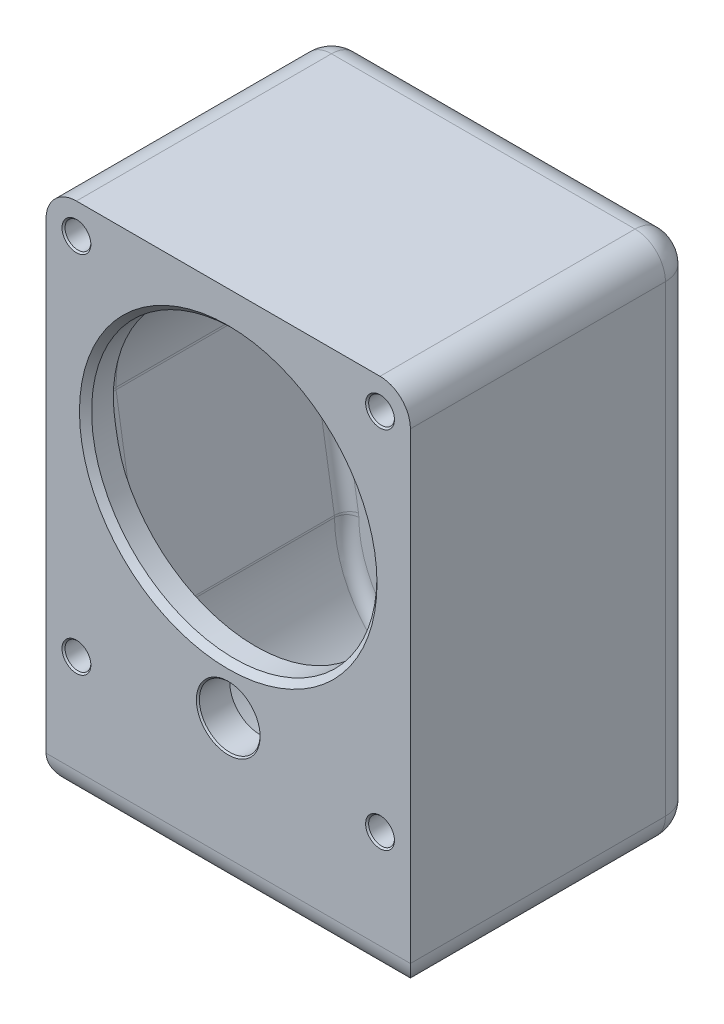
SolidWorks part; units mm, degrees
ref_plane "Face" through (0, 0, 0) normal (0, 0, 1) x (1, 0, 0)
ref_plane "Dessus" through (0, 0, 0) normal (0, 1, 0) x (1, 0, 0)
ref_plane "Droite" through (0, 0, 0) normal (1, 0, 0) x (0, 0, -1)
sketch "Esquisse1" plane through (0, 0, 0) normal (0, 0, 1) x (1, 0, 0)
  line L0 (-50, 62.5) -> (-40, 0)
  line L1 (-60, 122.5) -> (60, 122.5)
  line L2 (-60, 122.5) -> (-60, -50)
  line L3 (-60, -50) -> (60, -50)
  line L4 (60, 122.5) -> (60, -50)
  line L5 (50, 62.5) -> (40, 0)
  arc A0 (40, 0) -> (-40, 0) centre (0, 0) cw
  arc A1 (-50, 62.5) -> (50, 62.5) centre (0, 62.5) cw
  point P0 (0, 62.5)
  dimension "D2" = 40
  dimension "D3" = 50
  dimension "D1" = 62.5
  dimension "D4" = 60
  dimension "D5" = 60
  dimension "D6" = 60
  dimension "D7" = 60
  dimension "D8" = 50
extrude "Base-Extrusion" add sketch "Esquisse1" along normal blind 70
sketch "Esquisse3" plane through (0, 0, 70) normal (0, 0, 1) x (1, 0, 0)
  line L1 (-60, 122.5) -> (60, 122.5)
  line L2 (-60, 122.5) -> (-60, -50)
  line L3 (-60, -50) -> (60, -50)
  line L4 (60, 122.5) -> (60, -50)
extrude "Boss.-Extru.1" add sketch "Esquisse3" along normal blind 9
sketch "Esquisse5" plane through (0, 0, 70) normal (0, 0, -1) x (-1, 0, 0)
  circle A0 centre (0, 0) radius 10
  circle A1 centre (0, 0) radius 12.5
  dimension "D1" = 25
extrude "Boss.-Extru.2" add sketch "Esquisse5" along normal blind 1.5
sketch "Esquisse6" plane through (0, 0, 0) normal (0, 0, -1) x (-1, 0, 0)
  line L1 (-60, 122.5) -> (60, 122.5)
  line L2 (-60, 122.5) -> (-60, -50)
  line L3 (-60, -50) -> (60, -50)
  line L4 (60, 122.5) -> (60, -50)
extrude "Boss.-Extru.3" add sketch "Esquisse6" along normal blind 15
sketch "Esquisse7" plane through (0, 0, -15) normal (0, 0, -1) x (-1, 0, 0)
  circle A0 centre (0, 62.5) radius 40
  dimension "D1" = 80
  dimension "D2" = 62.5
extrude "Boss.-Extru.4" add sketch "Esquisse7" along normal blind 10
sketch "Esquisse8" plane through (0, 0, -25) normal (0, 0, -1) x (-1, 0, 0)
  line L0 (-60, 122.5) -> (-60, -50) construction
  circle A0 centre (0, 62.5) radius 13
  dimension "D2" = 26
  dimension "D1" = 62.5
  dimension "D3" = 60
extrude "Enlèv. mat.-Extru.2" cut sketch "Esquisse8" against normal blind 7
sketch "Esquisse9" plane through (0, 0, -18) normal (0, 0, -1) x (-1, 0, 0)
  circle A0 centre (0, 62.5) radius 25
  dimension "D1" = 50
  dimension "D2" = 62.5
extrude "Enlèv. mat.-Extru.3" cut sketch "Esquisse9" against normal blind 5
sketch "Esquisse11" plane through (0, 0, -13) normal (0, 0, -1) x (-1, 0, 0)
  circle A0 centre (0, 62.5) radius 30
  dimension "D1" = 60
  dimension "D2" = 62.5
extrude "Enlèv. mat.-Extru.4" cut sketch "Esquisse11" against normal through all
chamfer "Chanfrein1" distance 2 angle 45
sketch "Esquisse12" plane through (0, 0, 79) normal (0, 0, 1) x (1, 0, 0)
  circle A0 centre (0, 0) radius 10
  dimension "D1" = 20
extrude "Enlèv. mat.-Extru.5" cut sketch "Esquisse12" against normal through all
sketch "Esquisse13" plane through (0, 0, 0) normal (0, 0, 1) x (1, 0, 0)
  circle A0 centre (0, 0) radius 10
  circle A1 centre (0, 0) radius 12.5
  dimension "D1" = 20
  dimension "D2" = 25
extrude "Boss.-Extru.5" add sketch "Esquisse13" along normal blind 1.5
fillet "Congé1" radius 1.5
fillet "Congé16" radius 4
sketch "Esquisse14" plane through (0, 0, 79) normal (0, 0, 1) x (1, 0, 0)
  circle A0 centre (0, 62.9744) radius 47
  dimension "D1" = 94
extrude "Enlèv. mat.-Extru.6" cut sketch "Esquisse14" against normal blind 20
chamfer "Chanfrein3" distance 2 angle 45
fillet "Congé17" radius 10
fillet "Congé19" radius 5
hole_wizard "Trou taraudé M10x1.51" positions "Esquisse16" profile "Esquisse15"
sketch "Esquisse16" plane through (0, 0, 79) normal (0, 0, 1) x (1, 0, 0)
  line L0 (50, 122.5) -> (-50, 122.5) construction
  line L1 (-60, 112.5) -> (-60, -40) construction
  line L2 (60, -40) -> (60, 112.5) construction
  point P0 (50, 112.5)
  point P1 (-50, 112.5)
  point P2 (-50, -7.5)
  point P3 (50, -7.5)
  dimension "D1" = 10
  dimension "D2" = 10
  dimension "D3" = 10
  dimension "D4" = 10
  dimension "D5" = 10
  dimension "D6" = 10
  dimension "D7" = 130
  dimension "D8" = 130
sketch "Esquisse15" plane through (50, 112.5, 79) normal (1, 0, 0) x (0, -1, 0)
  line L0 (0, 0) -> (0, 30.0537)
  line L1 (0, 30.0537) -> (4.25, 27.5)
  line L2 (4.25, 27.5) -> (4.25, 0)
  line L5 (4.25, 0) -> (0, 0)
  line L10 (0, 30.0537) -> (-4.25, 27.5) construction
  line L11 (0, -6.35) -> (0, 107.95) construction
  dimension "Diamètre du perçage" = 8.5
  dimension "Profondeur du perçage" = 27.5
  dimension "Angle de pointe" = 118
chamfer "Chanfrein5" distance 0.5 angle 45
sketch "Esquisse18" plane through (0, 0, -13) normal (0, 0, 1) x (1, 0, 0)
  circle A0 centre (0, 62.5) radius 25.1159
  circle A1 centre (0, 62.5) radius 32.1278
  dimension "D1" = 62.5
extrude "Boss.-Extru.6" add sketch "Esquisse18" along normal blind 3
sketch "Esquisse19" plane through (0, 0, -18) normal (0, 0, 1) x (1, 0, 0)
  circle A0 centre (0, 62.5) radius 27.7335
  dimension "D1" = 62.5
extrude "Boss.-Extru.7" add sketch "Esquisse19" along normal blind 6
sketch "Esquisse20" plane through (0, 0, -12) normal (0, 0, 1) x (1, 0, 0)
  line L0 (-60, 112.5) -> (-60, -40) construction
  circle A0 centre (0, 62.5) radius 17.5
  dimension "D1" = 35
  dimension "D2" = 62.5
  dimension "D3" = 60
extrude "Enlèv. mat.-Extru.8" cut sketch "Esquisse20" against normal blind 6
fillet "Congé20" radius 2
sketch "Esquisse21" plane through (0, 0, -15) normal (0, 0, -1) x (-1, 0, 0)
  circle A0 centre (0, 0) radius 13
  dimension "D1" = 26
extrude "Boss.-Extru.8" add sketch "Esquisse21" along normal blind 4
fillet "Congé21" radius 3
chamfer "Chanfrein6" distance 1 angle 45
